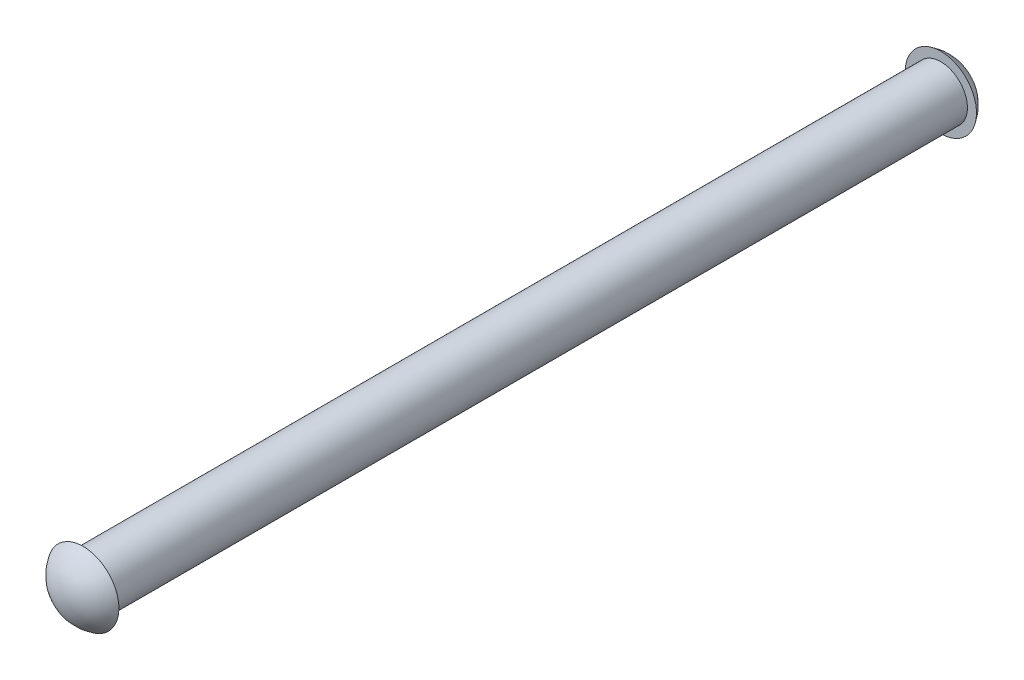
SolidWorks part; units mm, degrees
ref_plane "Plan de face" through (0, 0, 0) normal (0, 0, 1) x (1, 0, 0)
ref_plane "Plan de dessus" through (0, 0, 0) normal (0, 1, 0) x (1, 0, 0)
ref_plane "Plan de droite" through (0, 0, 0) normal (1, 0, 0) x (0, 0, -1)
sketch "Esquisse1" plane through (0, 0, 0) normal (1, 0, 0) x (0, 0, -1)
  line L0 (0, 0) -> (-43.1755, 0) construction
  line L1 (-40.25, 3.35) -> (-40.25, 2.5)
  line L2 (0, 0) -> (-42.15, 0)
  line L3 (0, 0) -> (0, 2.5)
  line L4 (0, 2.5) -> (-40.25, 2.5)
  line L5 (0, 0) -> (0, 5.3564) construction
  arc A0 (-40.25, 3.35) -> (-42.15, 0) centre (-38.2467, 0) ccw
  dimension "D1" = 5
  dimension "D2" = 80.5
  dimension "D3" = 6.7
  dimension "D4" = 84.3
revolve "Révolution1" add sketch "Esquisse1" angle 360 about L0
mirror "Symétrie1" about plane through (0, 0, 0) normal (0, 0, 1)
